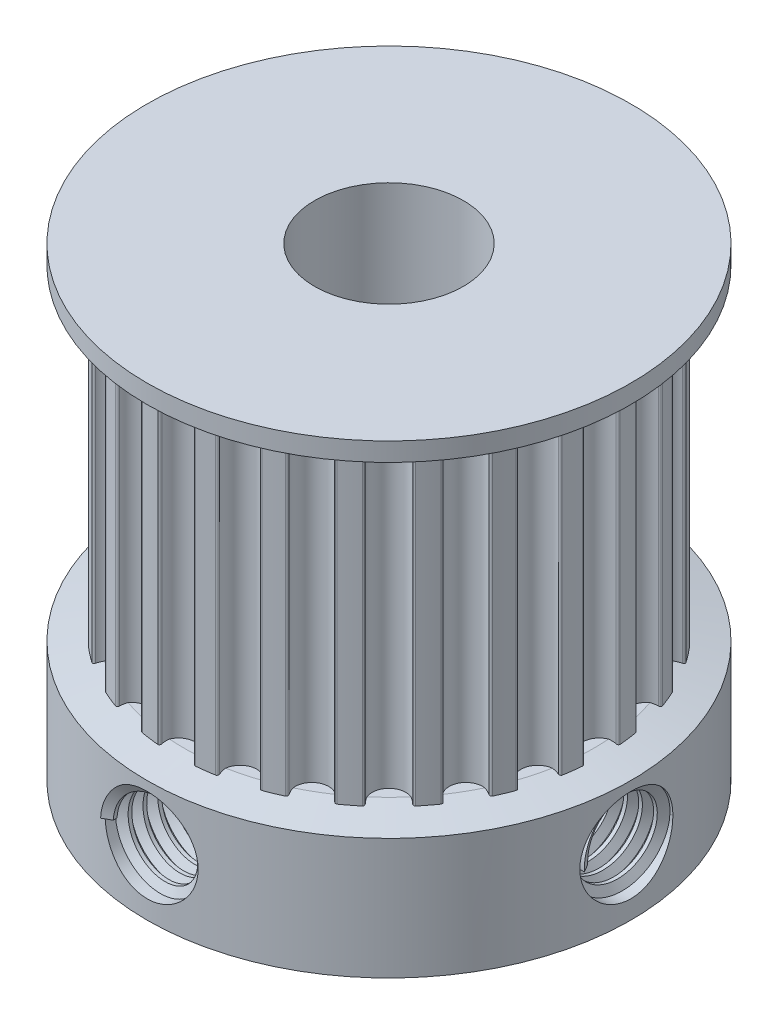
SolidWorks part; units mm, degrees
ref_plane "Спереди" through (0, 0, 0) normal (0, 0, 1) x (1, 0, 0)
ref_plane "Сверху" through (0, 0, 0) normal (0, 1, 0) x (1, 0, 0)
ref_plane "Справа" through (0, 0, 0) normal (1, 0, 0) x (0, 0, -1)
sketch "Эскиз1" plane through (0, 0, 0) normal (0, 1, 0) x (1, 0, 0)
  circle A0 centre (0, 0) radius 10.2892 construction
  circle A1 centre (0, 0) radius 11.4592
extrude "Бобышка-Вытянуть1" add sketch "Эскиз1" along normal blind 16.5
sketch "Эскиз2" plane through (0, 0, 0) normal (0, 1, 0) x (1, 0, 0)
  line L0 (-1.0126, 11.4143) -> (0, 13.9867)
  line L1 (0, 13.9867) -> (1.0126, 11.4143)
  line L2 (0, 0) -> (0, 11.4592) construction
  arc A0 (1.0126, 11.4143) -> (0.9, 11.3087) centre (1.0058, 11.3087) ccw
  arc A1 (0.9, 11.3087) -> (-0.9, 11.3087) centre (0, 11.3087) cw
  arc A2 (-0.9, 11.3087) -> (-1.0126, 11.4143) centre (-1.0058, 11.3087) ccw
  circle A3 centre (0, 0) radius 11.4592 construction
  dimension "D1" = 0.2117
  dimension "D2" = 1.8
  dimension "D3" = 1.0126
  dimension "D4" = 2.5724
  dimension "D5" = 1.0126
  dimension "D6" = 2.5724
  dimension "D7" = 1.8
extrude "Вырез-Вытянуть1" cut sketch "Эскиз2" along normal through all contours A1 A2 L0 L1 A0
pattern_circular "Круговой массив1" count 24 over 360 about axis through (0, 0, 0) along (0, 1, 0) of "Вырез-Вытянуть1"
sketch "Эскиз4" plane through (0, 0, 0) normal (0, 1, 0) x (1, 0, 0)
  circle A0 centre (0, 0) radius 13
  dimension "D1" = 26
extrude "Бобышка-Вытянуть2" add sketch "Эскиз4" against normal blind 7
sketch "Эскиз5" plane through (0, 16.5, 0) normal (0, 1, 0) x (1, 0, 0)
  circle A0 centre (0, 0) radius 13
  dimension "D1" = 26
extrude "Бобышка-Вытянуть3" add sketch "Эскиз5" along normal blind 1.5
sketch "Эскиз6" plane through (0, 0, 0) normal (0, 1, 0) x (1, 0, 0)
  circle A0 centre (0, 0) radius 4
  dimension "D1" = 8
extrude "Вырез-Вытянуть2" cut sketch "Эскиз6" along normal blind 18 and the other way through all
chamfer "Фаска1" distance 0.5 distance2 2 1 edges at (0, 0, 13)
chamfer "Фаска2" distance 2 distance2 0.5 1 edges at (0, 16.5, 13)
ref_plane "Плоскость1" through (0, 0, 13) normal (0, 0, 1) x (1, 0, 0)
sketch "Эскиз7" plane through (0, 0, 13) normal (0, 0, 1) x (1, 0, 0)
  line L0 (11.4592, 0) -> (-11.4592, 0) construction
  line L1 (-13, -0.5) -> (-13, -7) construction
  circle A0 centre (0, -3.5) radius 2.5
  dimension "D1" = 5
  dimension "D2" = 3.5
  dimension "D3" = 13
extrude "Вырез-Вытянуть3" cut sketch "Эскиз7" against normal up to next
thread "Резьба1" pitch 0.8 start angle 0, offset 0, length 8.5, pitch 0.8, diameter 5
ref_plane "Плоскость2" through (-2.5, -3.5, 13) normal (0, -1, 0) x (-1, 0, 0)
sketch "Профиль резьбы1" plane through (-2.5, -3.5, 13) normal (0, -1, 0) x (-1, 0, 0)
  line L0 (0, 0) -> (0, 0.8) construction
  line L11 (0, 0) -> (0, 0.7)
  line L12 (0, 0.7) -> (-0.433, 0.45)
  line L13 (-0.433, 0.45) -> (-0.433, 0.25)
  line L15 (-0.433, 0.25) -> (0, 0)
  line L17 (-0.433, 0.35) -> (0, 0.35) construction
  point P2 (0, 0)
  dimension "Pitch" = 0.8
  dimension "Profile_Angle" = 60
  dimension "Profile_Land" = 0.2
  dimension "Profile_Height" = 0.433
ref_plane "Плоскость3" through (13, 0, 0) normal (1, 0, 0) x (0, 0, -1)
sketch "Эскиз10" plane through (13, 0, 0) normal (1, 0, 0) x (0, 0, -1)
  line L0 (11.4592, 0) -> (-11.4592, 0) construction
  line L1 (13, -7) -> (13, -0.5) construction
  circle A0 centre (0, -3.5) radius 2.5
  dimension "D1" = 5
  dimension "D2" = 3.5
  dimension "D3" = 13
extrude "Вырез-Вытянуть4" cut sketch "Эскиз10" against normal up to next
thread "Резьба2" pitch 0.8 start angle 0, offset 0, length 8.5, pitch 0.8, diameter 5
ref_plane "Плоскость4" through (13, -3.5, 2.5) normal (0, -1, 0) x (0, 0, 1)
sketch "Профиль резьбы2" plane through (13, -3.5, 2.5) normal (0, -1, 0) x (0, 0, 1)
  line L0 (0, 0) -> (0, 0.8) construction
  line L11 (0, 0) -> (0, 0.7)
  line L12 (0, 0.7) -> (-0.433, 0.45)
  line L13 (-0.433, 0.45) -> (-0.433, 0.25)
  line L15 (-0.433, 0.25) -> (0, 0)
  line L17 (-0.433, 0.35) -> (0, 0.35) construction
  point P2 (0, 0)
  dimension "Pitch" = 0.8
  dimension "Profile_Angle" = 60
  dimension "Profile_Land" = 0.2
  dimension "Profile_Height" = 0.433
equation "\"Модуль\"= 3мм"
equation "\"Количество зубьев\"= 24"
equation "\"D1@Эскиз1\" = \"Модуль\" * \"Количество зубьев\" / pi - \"Высота зуба\" * 2"
equation "\"D2@Эскиз1\"= \"Модуль\" * \"Количество зубьев\" / pi"
equation "\"Высота зуба\"= 1.17"
equation "\"D1@Круговой массив1\"=\"Количество зубьев\""
